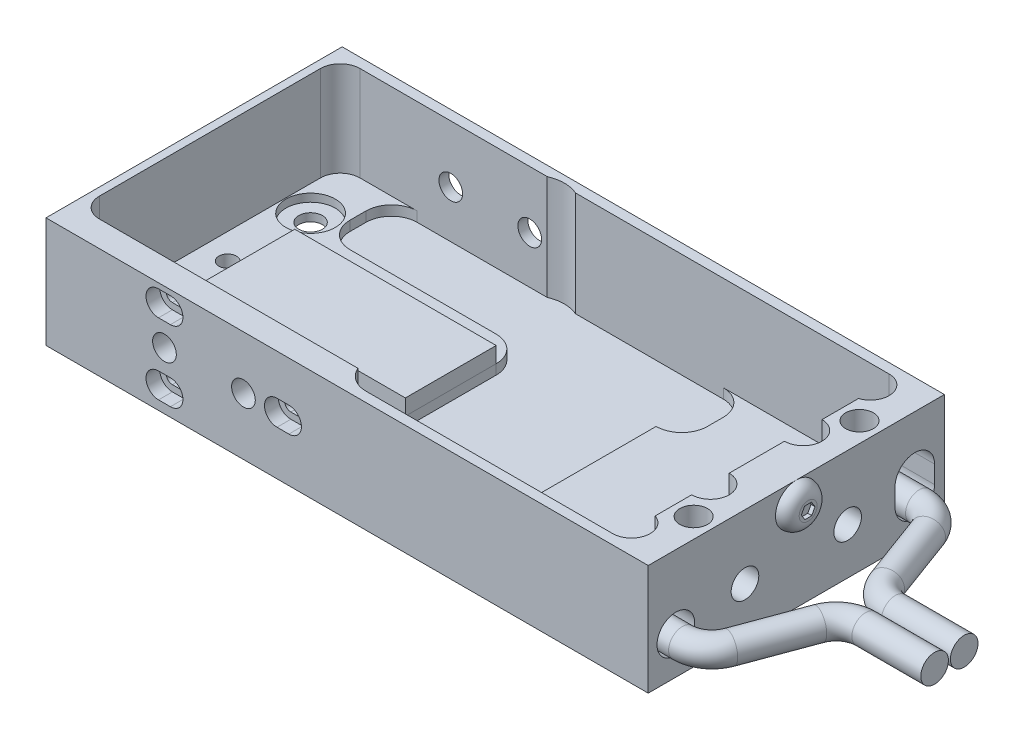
SolidWorks part; units mm, degrees
ref_plane "Front Plane" through (0, 0, 0) normal (0, 0, 1) x (1, 0, 0)
ref_plane "Top Plane" through (0, 0, 0) normal (0, 1, 0) x (1, 0, 0)
ref_plane "Right Plane" through (0, 0, 0) normal (1, 0, 0) x (0, 0, -1)
sketch "Sketch1" plane through (0, 0, 0) normal (0, 1, 0) x (1, 0, 0)
  line L1 (-38.735, -19.05) -> (38.735, -19.05)
  line L2 (-38.735, -19.05) -> (-38.735, 19.05)
  line L3 (-38.735, 19.05) -> (38.735, 19.05)
  line L4 (38.735, -19.05) -> (38.735, 19.05)
  line L5 (-38.735, -19.05) -> (38.735, 19.05) construction
  line L6 (-38.735, 19.05) -> (38.735, -19.05) construction
  point P0 (0, 0)
  dimension "D1" = 77.47
  dimension "D2" = 38.1
extrude "Base" add sketch "Sketch1" against normal blind 14.224
sketch "Hole Locations" plane through (0, 0, 0) normal (0, 1, 0) x (1, 0, 0)
  line L0 (-38.735, 0) -> (36.957, 0) construction
  line L1 (-38.735, 19.05) -> (-38.735, -19.05) construction
  line L2 (30.861, 10.668) -> (30.861, 0) construction
  line L3 (30.861, 0) -> (30.861, -10.668) construction
  line L4 (16.637, 12.954) -> (16.637, 0) construction
  line L5 (16.637, 0) -> (16.637, -12.954) construction
  line L6 (-8.255, 0) -> (-8.255, -19.05) construction
  line L7 (-38.735, -19.05) -> (38.735, -19.05) construction
  line L8 (-27.305, 0) -> (-27.305, -19.05) construction
  line L9 (-34.417, 0) -> (-34.417, -19.05) construction
  line L10 (36.957, 15.494) -> (36.957, 0) construction
  line L11 (36.957, 0) -> (36.957, -15.494) construction
  line L12 (38.735, 19.05) -> (-38.735, 19.05) construction
  point P19 (16.637, -6.477)
  dimension "D1" = 4.318
  dimension "D2" = 11.43
  dimension "D3" = 30.48
  dimension "D4" = 55.372
  dimension "D5" = 69.596
  dimension "D6" = 75.692
  dimension "D7" = 6.096
  dimension "D8" = 8.382
  dimension "D9" = 3.556
hole_wizard "#4-40 Tapped Hole1" positions "Sketch5" profile "Sketch6" tap size "#4-40" standard "ANSI Inch"
sketch "Sketch5" plane through (0, 0, 0) normal (0, 1, 0) x (-1, 0, 0)
  point P0 (34.417, 0)
  point P3 (-30.861, -10.668)
  point P6 (-30.861, 10.668)
sketch "Sketch6" plane through (-34.417, 0, 0) normal (1, 0, 0) x (0, 0, 1)
  line L0 (0, 0) -> (0, 14.224)
  line L1 (0, 14.224) -> (1.1303, 14.224)
  line L2 (1.1303, 14.224) -> (1.1303, 0)
  line L5 (1.1303, 0) -> (0, 0)
  line L11 (0, -6.35) -> (0, 107.95) construction
  dimension "Thru Tap Drill Dia." = 2.2606
  dimension "Thru Tap Drill Depth" = 14.224
sketch "Sketch7" plane through (0, 0, 0) normal (0, 1, 0) x (1, 0, 0)
  line L0 (-38.735, -19.05) -> (38.735, -19.05) construction
  line L1 (-38.735, 19.05) -> (-38.735, -19.05) construction
  circle A0 centre (36.195, 10.668) radius 1.778
  circle A1 centre (36.195, -10.668) radius 1.778
  dimension "D3" = 3.556
  dimension "D1" = 29.718
  dimension "D2" = 8.382
  dimension "D4" = 74.93
extrude "2 Thru Holes" cut sketch "Sketch7" against normal through all
sketch "Sketch8" plane through (0, 0, 0) normal (0, 1, 0) x (1, 0, 0)
  line L0 (-31.115, 17.78) -> (-11.0901, 17.78)
  line L1 (14.859, 17.78) -> (14.859, 9.144)
  line L2 (14.859, 9.144) -> (11.557, 9.144)
  line L3 (11.557, 9.144) -> (11.557, -9.144)
  line L4 (11.557, -9.144) -> (14.859, -9.144)
  line L5 (14.859, -9.144) -> (14.859, -17.78)
  line L6 (14.859, -17.78) -> (1.143, -17.78)
  line L7 (-1.905, -15.748) -> (-31.115, -15.748)
  line L8 (-31.115, -15.748) -> (-31.115, -9.144)
  line L9 (-31.115, -9.144) -> (-5.715, -9.144)
  line L10 (-5.715, -9.144) -> (-5.715, 9.144)
  line L11 (-5.715, 9.144) -> (-31.115, 9.144)
  line L12 (-31.115, 9.144) -> (-31.115, 17.78)
  line L13 (-7.4519, 17.78) -> (14.859, 17.78)
  line L14 (-38.735, 19.05) -> (-38.735, -19.05) construction
  line L15 (-9.271, 18.161) -> (-7.4519, 18.161) construction
  line L16 (-7.4519, 18.161) -> (-7.4519, 17.78) construction
  line L17 (-38.735, -19.05) -> (38.735, -19.05) construction
  arc A0 (1.143, -17.78) -> (-1.905, -15.748) centre (1.143, -14.478) cw
  arc A1 (-11.0901, 17.78) -> (-7.4519, 17.78) centre (-9.271, 13.6276) cw
  dimension "D12" = 3.302
  dimension "D1" = 29.464
  dimension "D2" = 0.381
  dimension "D3" = 1.27
  dimension "D4" = 3.302
  dimension "D5" = 9.906
  dimension "D6" = 28.194
  dimension "D7" = 36.83
  dimension "D8" = 50.292
  dimension "D9" = 33.02
  dimension "D10" = 36.83
  dimension "D11" = 3.302
  dimension "D13" = 7.62
extrude "0.53 DP" cut sketch "Sketch8" against normal blind 13.462
fillet "Fillet1" radius 3.302 10 edges at (14.859, -6.731, 17.78) (14.859, -6.731, 9.144) (14.859, -6.731, -9.144) (14.859, -6.731, -17.78) (-31.115, -6.731, 9.144) (-31.115, -6.731, 15.748) (-5.715, -6.731, 9.144) (-5.715, -6.731, -9.144) (-31.115, -6.731, -9.144) (-31.115, -6.731, -17.78)
sketch "Sketch9" plane through (0, 0, 0) normal (0, 1, 0) x (1, 0, 0)
  line L0 (-1.905, 17.78) -> (-1.905, -15.748)
  line L1 (11.557, 17.78) -> (-7.4519, 17.78) construction
  line L2 (-1.905, -15.748) -> (-35.179, -15.748)
  line L3 (-37.719, -13.208) -> (-37.719, 15.24)
  line L4 (-35.179, 17.78) -> (-1.905, 17.78)
  line L5 (-38.735, 19.05) -> (-38.735, -19.05) construction
  line L6 (11.557, 17.78) -> (11.557, -17.78)
  line L7 (11.557, -17.78) -> (32.893, -17.78)
  line L8 (32.893, -12.954) -> (27.051, -12.954)
  line L9 (27.051, -12.954) -> (27.051, -8.382)
  line L10 (27.051, -8.382) -> (33.655, -8.382)
  line L11 (33.655, -3.556) -> (33.655, 3.556)
  line L12 (33.655, 8.382) -> (27.051, 8.382)
  line L13 (27.051, 8.382) -> (27.051, 12.954)
  line L14 (27.051, 12.954) -> (32.893, 12.954)
  line L15 (32.893, 17.78) -> (11.557, 17.78)
  line L16 (-38.735, -19.05) -> (38.735, -19.05) construction
  line L17 (27.051, -10.668) -> (38.735, -10.668) construction
  line L18 (38.735, -19.05) -> (38.735, 19.05) construction
  arc A0 (-35.179, -15.748) -> (-37.719, -13.208) centre (-35.179, -13.208) cw
  arc A1 (-37.719, 15.24) -> (-35.179, 17.78) centre (-35.179, 15.24) cw
  arc A2 (32.893, -17.78) -> (32.893, -12.954) centre (32.893, -15.367) ccw
  arc A3 (33.655, -8.382) -> (33.655, -3.556) centre (33.655, -5.969) ccw
  arc A4 (33.655, 3.556) -> (33.655, 8.382) centre (33.655, 5.969) ccw
  arc A5 (32.893, 12.954) -> (32.893, 17.78) centre (32.893, 15.367) ccw
  dimension "D1" = 2.54
  dimension "D2" = 1.016
  dimension "D3" = 6.096
  dimension "D4" = 65.786
  dimension "D5" = 71.628
  dimension "D6" = 72.39
  dimension "D7" = 8.382
extrude "0.48 DP" cut sketch "Sketch9" against normal blind 12.192
sketch "Sketch10" plane through (0, -12.192, 0) normal (0, 1, 0) x (1, 0, 0)
  line L0 (-38.735, 19.05) -> (-38.735, -19.05) construction
  line L1 (-5.715, 5.842) -> (-31.623, 5.842)
  line L2 (-5.715, 5.842) -> (-5.715, -5.842)
  line L3 (-5.715, -5.842) -> (-31.623, -5.842)
  line L4 (-31.623, 5.842) -> (-31.623, -5.842)
  dimension "D1" = 7.112
extrude "0.40 DP" add sketch "Sketch10" along normal blind 2.032 separate body
sketch "CB Locations" plane through (0, 0, 0) normal (0, 1, 0) x (1, 0, 0)
  line L0 (-34.417, 0) -> (-34.417, -10.668) construction
  line L1 (-38.735, -19.05) -> (38.735, -19.05) construction
  line L2 (-34.417, 0) -> (-34.417, 10.668) construction
  line L3 (-38.735, 19.05) -> (-38.735, -19.05) construction
  circle A0 centre (-34.417, 10.668) radius 1.524
  circle A1 centre (-34.417, -10.668) radius 1.524
  dimension "D3" = 3.048
  dimension "D1" = 8.382
  dimension "D2" = 4.318
extrude "Thru Hole" cut sketch "CB Locations" against normal through all contours A0
sketch "Sketch12" plane through (0, -12.192, 0) normal (0, 1, 0) x (1, 0, 0)
  circle A0 centre (-34.417, 10.668) radius 3.175
  circle A1 centre (-34.417, -10.668) radius 3.175
  dimension "D1" = 6.35
extrude "Counterbore" cut sketch "Sketch12" against normal blind 1.016
sketch "Sketch13" plane through (0, 0, 0) normal (0, 1, 0) x (1, 0, 0)
  line L0 (33.655, -3.556) -> (33.655, 3.556) construction
  line L1 (33.655, 14.6006) -> (19.927, 14.6006)
  line L2 (33.655, 14.6006) -> (33.655, -15.3568)
  line L3 (33.655, -15.3568) -> (19.927, -15.3568)
  line L4 (19.927, 14.6006) -> (19.927, -15.3568)
extrude "Shelf 0.40 DP" cut sketch "Sketch13" against normal blind 10.16
sketch "Sketch14" plane through (0, 0, -19.05) normal (0, 0, -1) x (-1, 0, 0)
  line L0 (38.735, -14.224) -> (38.735, 0) construction
  circle A0 centre (23.495, -7.366) radius 1.524
  circle A1 centre (13.335, -7.366) radius 1.524
  dimension "D4" = 3.048
  dimension "D1" = 7.366
  dimension "D2" = 15.24
  dimension "D3" = 25.4
extrude "2 Side Holes" cut sketch "Sketch14" against normal blind 5.08
sketch "Sketch15" plane through (0, 0, 19.05) normal (0, 0, 1) x (1, 0, 0)
  line L0 (-24.257, -2.286) -> (-22.733, -2.286) construction
  line L1 (-24.257, -1.4859) -> (-22.733, -1.4859)
  line L2 (-24.257, -3.0861) -> (-22.733, -3.0861)
  line L3 (-24.257, -11.43) -> (-22.733, -11.43) construction
  line L4 (-24.257, -10.6299) -> (-22.733, -10.6299)
  line L5 (-24.257, -12.2301) -> (-22.733, -12.2301)
  line L6 (-9.017, -6.858) -> (-7.493, -6.858) construction
  line L7 (-9.017, -6.0579) -> (-7.493, -6.0579)
  line L8 (-9.017, -7.6581) -> (-7.493, -7.6581)
  line L9 (-38.735, -14.224) -> (-38.735, 0) construction
  line L10 (-38.735, 0) -> (38.735, 0) construction
  circle A0 centre (-23.495, -6.858) radius 1.524
  circle A1 centre (-13.335, -6.858) radius 1.524
  arc A2 (-24.257, -1.4859) -> (-24.257, -3.0861) centre (-24.257, -2.286) ccw
  arc A3 (-22.733, -3.0861) -> (-22.733, -1.4859) centre (-22.733, -2.286) ccw
  arc A4 (-24.257, -10.6299) -> (-24.257, -12.2301) centre (-24.257, -11.43) ccw
  arc A5 (-22.733, -12.2301) -> (-22.733, -10.6299) centre (-22.733, -11.43) ccw
  arc A6 (-9.017, -6.0579) -> (-9.017, -7.6581) centre (-9.017, -6.858) ccw
  arc A7 (-7.493, -7.6581) -> (-7.493, -6.0579) centre (-7.493, -6.858) ccw
  point P6 (-23.495, -2.286)
  point P11 (-23.495, -11.43)
  point P18 (-8.255, -6.858)
  dimension "D2" = 3.048
  dimension "D3" = 0.8001
  dimension "D1" = 25.4
  dimension "D4" = 1.524
  dimension "D5" = 15.24
  dimension "D6" = 6.858
  dimension "D7" = 2.286
  dimension "D8" = 11.43
  dimension "D9" = 30.48
extrude "5 Side Holes" cut sketch "Sketch15" against normal blind 5.08
sketch "Sketch16" plane through (0, 0, 19.05) normal (0, 0, 1) x (1, 0, 0)
  line L20 (-22.733, -9.8171) -> (-24.257, -9.8171)
  line L21 (-24.257, -13.0429) -> (-22.733, -13.0429)
  line L22 (-22.733, -10.6299) -> (-24.257, -10.6299)
  line L23 (-24.257, -12.2301) -> (-22.733, -12.2301)
  line L24 (-22.733, -10.6299) -> (-24.257, -10.6299) construction
  line L25 (-24.257, -12.2301) -> (-22.733, -12.2301) construction
  line L26 (-7.493, -6.0579) -> (-9.017, -6.0579)
  line L27 (-9.017, -7.6581) -> (-7.493, -7.6581)
  line L28 (-7.493, -6.0579) -> (-9.017, -6.0579) construction
  line L29 (-9.017, -7.6581) -> (-7.493, -7.6581) construction
  line L30 (-22.733, -1.4859) -> (-24.257, -1.4859)
  line L31 (-24.257, -3.0861) -> (-22.733, -3.0861)
  line L32 (-22.733, -1.4859) -> (-24.257, -1.4859) construction
  line L33 (-24.257, -3.0861) -> (-22.733, -3.0861) construction
  line L34 (-7.493, -5.2451) -> (-9.017, -5.2451)
  line L35 (-9.017, -8.4709) -> (-7.493, -8.4709)
  line L36 (-22.733, -0.6731) -> (-24.257, -0.6731)
  line L37 (-24.257, -3.8989) -> (-22.733, -3.8989)
  arc A16 (-24.257, -9.8171) -> (-24.257, -13.0429) centre (-24.257, -11.43) ccw
  arc A17 (-22.733, -13.0429) -> (-22.733, -9.8171) centre (-22.733, -11.43) ccw
  arc A18 (-24.257, -10.6299) -> (-24.257, -12.2301) centre (-24.257, -11.43) ccw
  arc A19 (-22.733, -12.2301) -> (-22.733, -10.6299) centre (-22.733, -11.43) ccw
  arc A20 (-24.257, -10.6299) -> (-24.257, -12.2301) centre (-24.257, -11.43) ccw construction
  arc A21 (-22.733, -12.2301) -> (-22.733, -10.6299) centre (-22.733, -11.43) ccw construction
  arc A22 (-9.017, -6.0579) -> (-9.017, -7.6581) centre (-9.017, -6.858) ccw
  arc A23 (-7.493, -7.6581) -> (-7.493, -6.0579) centre (-7.493, -6.858) ccw
  arc A24 (-9.017, -6.0579) -> (-9.017, -7.6581) centre (-9.017, -6.858) ccw construction
  arc A25 (-7.493, -7.6581) -> (-7.493, -6.0579) centre (-7.493, -6.858) ccw construction
  arc A26 (-24.257, -1.4859) -> (-24.257, -3.0861) centre (-24.257, -2.286) ccw
  arc A27 (-22.733, -3.0861) -> (-22.733, -1.4859) centre (-22.733, -2.286) ccw
  arc A28 (-24.257, -1.4859) -> (-24.257, -3.0861) centre (-24.257, -2.286) ccw construction
  arc A29 (-22.733, -3.0861) -> (-22.733, -1.4859) centre (-22.733, -2.286) ccw construction
  arc A30 (-9.017, -5.2451) -> (-9.017, -8.4709) centre (-9.017, -6.858) ccw
  arc A31 (-7.493, -8.4709) -> (-7.493, -5.2451) centre (-7.493, -6.858) ccw
  arc A32 (-24.257, -0.6731) -> (-24.257, -3.8989) centre (-24.257, -2.286) ccw
  arc A33 (-22.733, -3.8989) -> (-22.733, -0.6731) centre (-22.733, -2.286) ccw
  dimension "D1" = 0
  dimension "D2" = 0
  dimension "D3" = 0
  dimension "D4" = 0.8128
extrude "Slot CB" cut sketch "Sketch16" against normal blind 1.778
sketch "Sketch18" plane through (38.735, 0, 0) normal (1, 0, 0) x (0, 0, -1)
  line L0 (15.24, -9.398) -> (15.24, -7.112) construction
  line L1 (12.7, -9.398) -> (12.7, -7.112)
  line L2 (17.78, -9.398) -> (17.78, -7.112)
  line L3 (-19.05, -14.224) -> (-19.05, 0) construction
  line L4 (-19.05, 0) -> (19.05, 0) construction
  line L5 (15.24, -7.112) -> (15.24, -4.572) construction
  line L6 (15.24, -9.398) -> (15.24, -11.938) construction
  circle A0 centre (-15.494, -9.398) radius 2.4257
  circle A1 centre (-6.604, -8.255) radius 1.778
  circle A2 centre (6.604, -8.255) radius 1.778
  arc A3 (12.7, -9.398) -> (17.78, -9.398) centre (15.24, -9.398) ccw
  arc A4 (17.78, -7.112) -> (12.7, -7.112) centre (15.24, -7.112) ccw
  point P8 (15.24, -8.255)
  dimension "D2" = 4.8514
  dimension "D6" = 3.556
  dimension "D8" = 2.54
  dimension "D1" = 3.556
  dimension "D3" = 9.398
  dimension "D4" = 12.446
  dimension "D5" = 25.654
  dimension "D7" = 8.255
  dimension "D9" = 11.938
  dimension "D10" = 4.572
  dimension "D11" = 31.75
extrude "Short Side Thrus" cut sketch "Sketch18" against normal blind 6.096
sketch "Sketch19" plane through (38.735, 0, 0) normal (1, 0, 0) x (0, 0, -1)
  circle A0 centre (0, -2.6797) radius 2.6797
  dimension "D1" = 5.3594
extrude "Side Screw" add sketch "Sketch19" along normal blind 1.524
fillet "Screw Fillet" radius 1.524 1 edges at (40.259, -2.6797, -2.6797)
sketch "Sketch20" plane through (40.259, 0, 0) normal (1, 0, 0) x (0, 0, -1)
  line L1 (0.4135, -1.903) -> (-0.4659, -1.9333)
  line L2 (-0.4659, -1.9333) -> (-0.8794, -2.7099)
  line L3 (-0.8794, -2.7099) -> (-0.4135, -3.4564)
  line L4 (-0.4135, -3.4564) -> (0.4659, -3.4261)
  line L5 (0.4659, -3.4261) -> (0.8794, -2.6495)
  line L6 (0.8794, -2.6495) -> (0.4135, -1.903)
  circle A0 centre (0, -2.6797) radius 0.762 construction
  dimension "D1" = 1.524
extrude "Screw Hex" cut sketch "Sketch20" against normal blind 0.508
sketch "Sketch21" plane through (33.655, 0, 0) normal (-1, 0, 0) x (0, 0, 1)
  line L0 (-15.24, -12.192) -> (-15.24, 0) construction
  circle A0 centre (-15.24, -10.1791) radius 1.778
  dimension "D1" = 3.556
sketch "Sketch22" plane through (0, -14.224, 0) normal (0, -1, 0) x (1, 0, 0)
  line L0 (38.735, -19.05) -> (-38.735, -19.05) construction
  line L1 (33.655, -13.462) -> (33.655, -17.018) construction
  line L2 (33.655, -15.24) -> (39.3246, -15.24)
  line L3 (42.8982, -12.7514) -> (45.9885, -4.3936)
  line L4 (49.5621, -1.905) -> (58.4278, -1.905)
  arc A0 (39.3246, -15.24) -> (42.8982, -12.7514) centre (39.3246, -11.43) ccw
  arc A1 (45.9885, -4.3936) -> (49.5621, -1.905) centre (49.5621, -5.715) cw
  dimension "D1" = 3.81
  dimension "D2" = 17.145
sweep "Cords" add profiles "Sketch21" path "Sketch22"
mirror "Mirror2" about plane through (0, 0, 0) normal (0, 0, 1) of "Cords"
